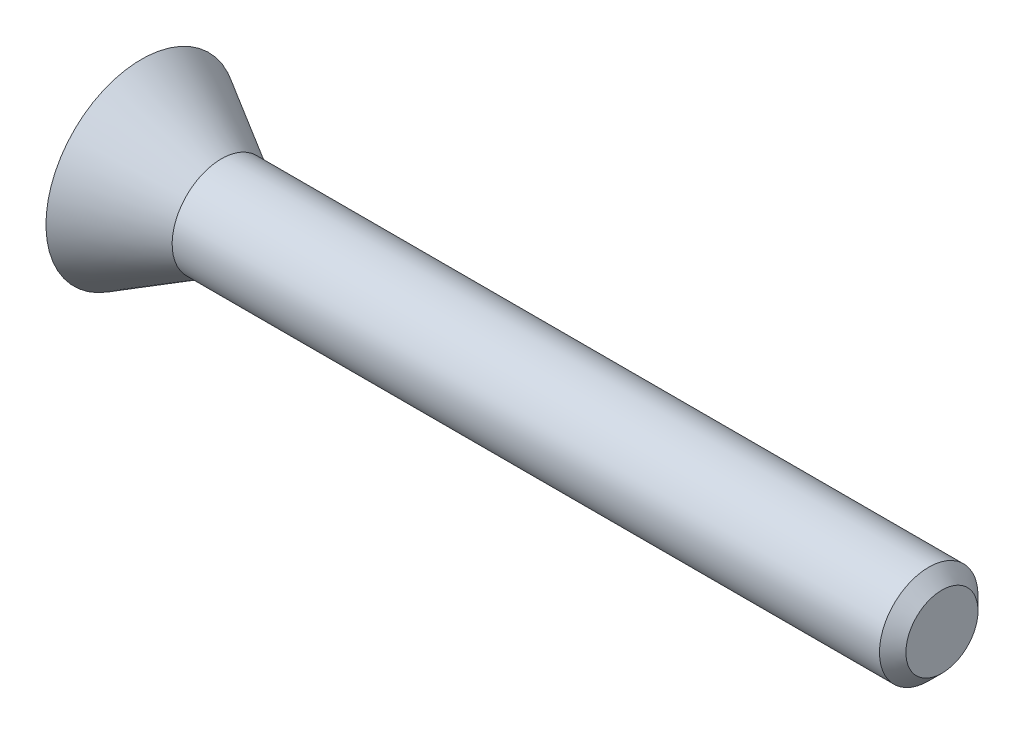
SolidWorks part; units mm, degrees
ref_plane "Front Plane" through (0, 0, 0) normal (0, 0, 1) x (1, 0, 0)
ref_plane "Top Plane" through (0, 0, 0) normal (0, 1, 0) x (1, 0, 0)
ref_plane "Right Plane" through (0, 0, 0) normal (1, 0, 0) x (0, 0, -1)
sketch "Sketch1" plane through (0, 0, 0) normal (1, 0, 0) x (0, 0, -1)
  circle A0 centre (0, 0) radius 1.55
  dimension "D1" = 3.1
extrude "Boss-Extrude1" add sketch "Sketch1" along normal mid plane 13 contours A0
sketch "Sketch2" plane through (0, 0, 0) normal (0, 0, 1) x (1, 0, 0)
  line L0 (-5.201, 0.8) -> (6.5, 0.8)
  line L1 (6.5, -1.55) -> (6.5, 1.55) construction
  line L2 (6.5, 0.8) -> (6.5, 1.55)
  line L3 (-5.201, 0.8) -> (-6.5, 1.55)
  line L4 (-6.5, 1.55) -> (6.5, 1.55)
  line L5 (-6.5, 1.55) -> (-6.5, -1.55) construction
  line L6 (-6.5, 0) -> (6.5, 0) construction
  dimension "D1" = 30
  dimension "D2" = 1.6
revolve "Cut-Revolve1" cut sketch "Sketch2" angle 360 about L6
sketch "Sketch3" plane through (-6.5, 0, 0) normal (-1, 0, 0) x (0, 0, 1)
  line L1 (0.155, 0.68) -> (0.155, -1.025)
  line L2 (0.37, 0.68) -> (0.155, 0.68)
  line L3 (0, 1.3) -> (0.37, 0.68)
  line L4 (0, 1.3) -> (-0.37, 0.68)
  line L5 (-0.37, 0.68) -> (-0.155, 0.68)
  line L6 (-0.155, 0.68) -> (-0.155, -1.025)
  line L7 (0, 1.55) -> (0, -1.55) construction
  arc A0 (-0.155, -1.025) -> (0.155, -1.025) centre (0, -1.025) ccw
  circle A1 centre (0, 0) radius 1.55 construction
  dimension "D6" = 0.31
  dimension "D2" = 0.37
  dimension "D3" = 0.74
  dimension "D1" = 0.25
  dimension "D5" = 0.62
extrude "Cut-Extrude1" cut sketch "Sketch3" against normal blind 0.4
chamfer "Chamfer1" distance 0.2145 angle 45 1 edges at (6.5, -0.8, 0)
sketch "Sketch4" plane through (-6.5, 0, 0) normal (-1, 0, 0) x (0, 0, 1)
  text T0 "2  7" font "Bahnschrift" height 1.3
  dimension "D1" = 0.75
extrude "Cut-Extrude2" cut sketch "Sketch4" against normal blind 0.4
